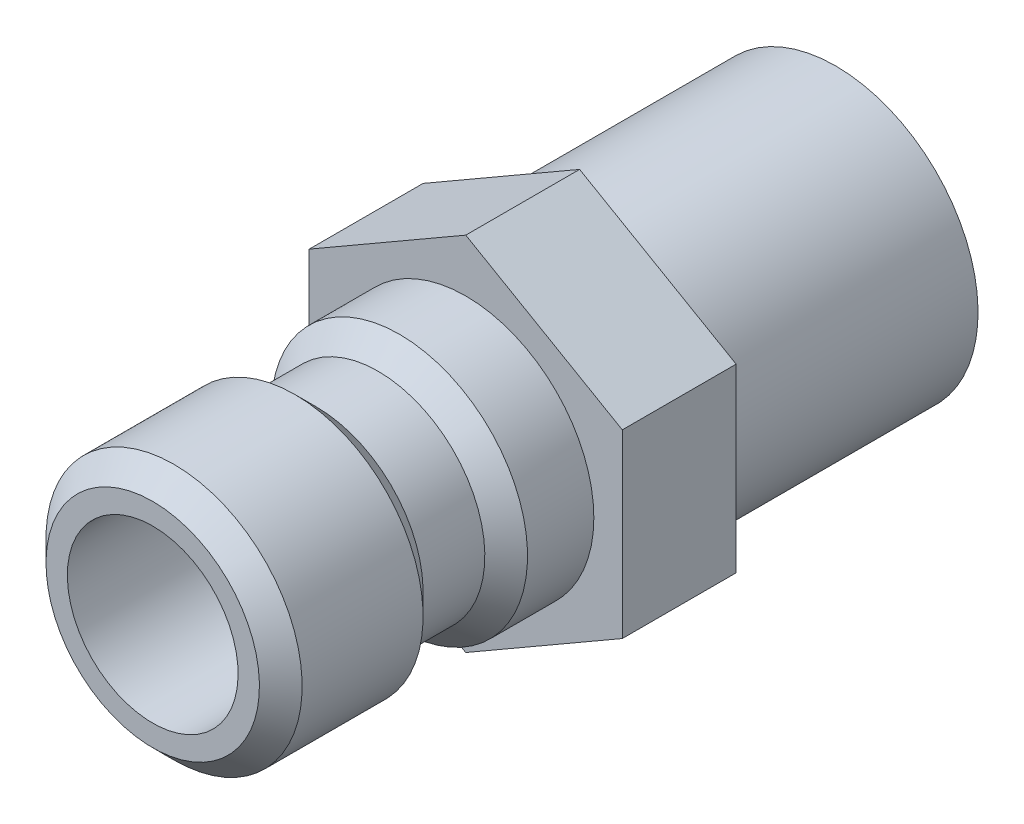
SolidWorks part; units mm, degrees
ref_plane "Front Plane" through (0, 0, 0) normal (0, 0, 1) x (1, 0, 0)
ref_plane "Top Plane" through (0, 0, 0) normal (0, 1, 0) x (1, 0, 0)
ref_plane "Right Plane" through (0, 0, 0) normal (1, 0, 0) x (0, 0, -1)
sketch "Sketch1" plane through (0, 0, 0) normal (1, 0, 0) x (0, 0, -1)
  line L0 (4, 0) -> (-14.175, 0) construction
  line L1 (-11, 3) -> (-11, 3.75)
  line L2 (-5.25, 3.75) -> (-5.25, 0) construction
  line L3 (-10.25, 4.5) -> (-6, 4.5)
  line L4 (4, 5) -> (4, 0) construction
  line L5 (-5.25, 3.75) -> (-3.08, 3.75)
  line L6 (-2.33, 4.5) -> (4, 4.5)
  line L7 (4, 4.5) -> (4, 5)
  line L8 (-5.25, 3.75) -> (-6, 4.5)
  line L9 (-3.08, 3.75) -> (-2.33, 4.5)
  line L10 (-11, 3.75) -> (-10.25, 4.5)
  line L11 (-11, 3) -> (13, 3)
  line L12 (4, 5) -> (6.142, 5)
  line L13 (6.142, 5) -> (13, 5)
  line L14 (13, 5) -> (13, 3)
  line L15 (0, 0) -> (0, 4.5) construction
  dimension "D1" = 15
  dimension "D2" = 2.17
  dimension "D3" = 0.75
  dimension "D4" = 45
  dimension "D5" = 5.75
  dimension "D6" = 45
  dimension "D7" = 0
  dimension "D8" = 6.858
  dimension "D9" = 24
  dimension "D10" = 3.175
  dimension "D11" = 4
  dimension "D12" = 6
  dimension "D13" = 11
  dimension "D14" = 9
  dimension "D15" = 10
revolve "Revolve1" add sketch "Sketch1" angle 360 about L0
sketch "Sketch2" plane through (0, 0, 0) normal (0, 0, 1) x (1, 0, 0)
  line L1 (-5.5, 3.1754) -> (-5.5, -3.1754)
  line L2 (-5.5, -3.1754) -> (0, -6.3509)
  line L3 (0, -6.3509) -> (5.5, -3.1754)
  line L4 (5.5, -3.1754) -> (5.5, 3.1754)
  line L5 (5.5, 3.1754) -> (0, 6.3509)
  line L6 (0, 6.3509) -> (-5.5, 3.1754)
  circle A0 centre (0, 0) radius 5.5 construction
  circle A1 centre (0, 0) radius 3 construction
  circle A2 centre (0, 0) radius 3
  dimension "D1" = 11
extrude "Boss-Extrude1" add sketch "Sketch2" against normal up to vertex (4 mm away)
